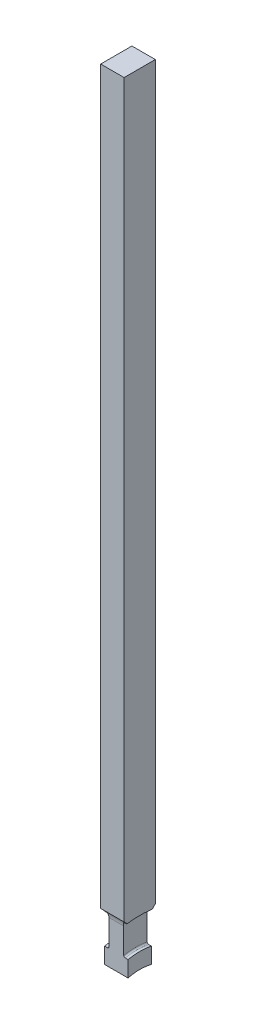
SolidWorks part; units mm, degrees
ref_plane "Front Plane" through (0, 0, 0) normal (0, 0, 1) x (1, 0, 0)
ref_plane "Top Plane" through (0, 0, 0) normal (0, 1, 0) x (1, 0, 0)
ref_plane "Right Plane" through (0, 0, 0) normal (1, 0, 0) x (0, 0, -1)
sketch "Sketch1" plane through (0, 0, 0) normal (1, 0, 0) x (0, 0, -1)
  line L0 (-4, 212) -> (-4, 0)
  line L1 (0, 249.2329) -> (0, 0) construction
  line L2 (4, 212) -> (4, 0)
  line L3 (-4, 212) -> (4, 212)
  line L6 (-4, 0) -> (4, 0)
  arc A0 (-12, 0) -> (12, 0) centre (0, 0) cw construction
  dimension "R" = 12
  dimension "L" = 200
  dimension "T" = 8
extrude "Boss-Extrude1" add sketch "Sketch1" along normal mid plane 6
sketch "Sketch8" plane through (0, 0, 0) normal (1, 0, 0) x (0, 0, -1)
  circle A0 centre (0, 0) radius 12
  arc A1 (12, 0) -> (-12, 0) centre (0, 0) ccw construction
extrude "Cut-Extrude4" cut sketch "Sketch8" against normal through all both and the other way through all
sketch "Sketch2" plane through (0, 0, 0) normal (0, 0, 1) x (1, 0, 0)
  line L0 (3, 16) -> (1.905, 16)
  line L1 (3, 212) -> (3, 11.3137) construction
  line L2 (1.905, 16) -> (1.905, 24)
  line L3 (1.905, 24) -> (3, 24)
  line L4 (3, 24) -> (3, 16)
  line L5 (0, 29.9173) -> (0, 0) construction
  line L6 (-3, 24) -> (-3, 16)
  line L7 (-1.905, 24) -> (-3, 24)
  line L8 (-1.905, 16) -> (-1.905, 24)
  line L9 (-3, 16) -> (-1.905, 16)
  line L10 (-8.8482, 0) -> (24.5305, 0) construction
  dimension "D1" = 3.81
  dimension "D2" = 24
  dimension "D3" = 16
revolve "Cut-Revolve1" cut sketch "Sketch2" angle 360 about L10
sketch "Sketch6" plane through (0, 0, 0) normal (1, 0, 0) x (0, 0, -1)
  line L0 (0, 19.903) -> (0, 0) construction
  line L1 (3, 0) -> (22.05, 0)
  line L2 (3, 0) -> (3, 22.6124)
  line L3 (5.3876, 25) -> (22.05, 25)
  line L4 (22.05, 0) -> (22.05, 25)
  line L9 (-3, 0) -> (-22.05, 0)
  line L10 (-22.05, 0) -> (-22.05, 25)
  line L11 (-5.3876, 25) -> (-22.05, 25)
  line L12 (-3, 0) -> (-3, 22.6124)
  arc A0 (3, 22.6124) -> (5.3876, 25) centre (5.3876, 22.6124) cw
  arc A1 (-3, 22.6124) -> (-5.3876, 25) centre (-5.3876, 22.6124) ccw
  dimension "D3" = 2.3876
  dimension "D1" = 25
  dimension "MT" = 6
  dimension "D2" = 19.05
extrude "Cut-Extrude2" cut sketch "Sketch6" against normal through all both and the other way through all
fillet "Fillet1" radius 0.762 2 edges at (-1.905, 24, 0) (1.905, 24, 0)
fillet "Fillet2" radius 0.381 2 edges at (-1.905, 16, 0) (1.905, 16, 0)
